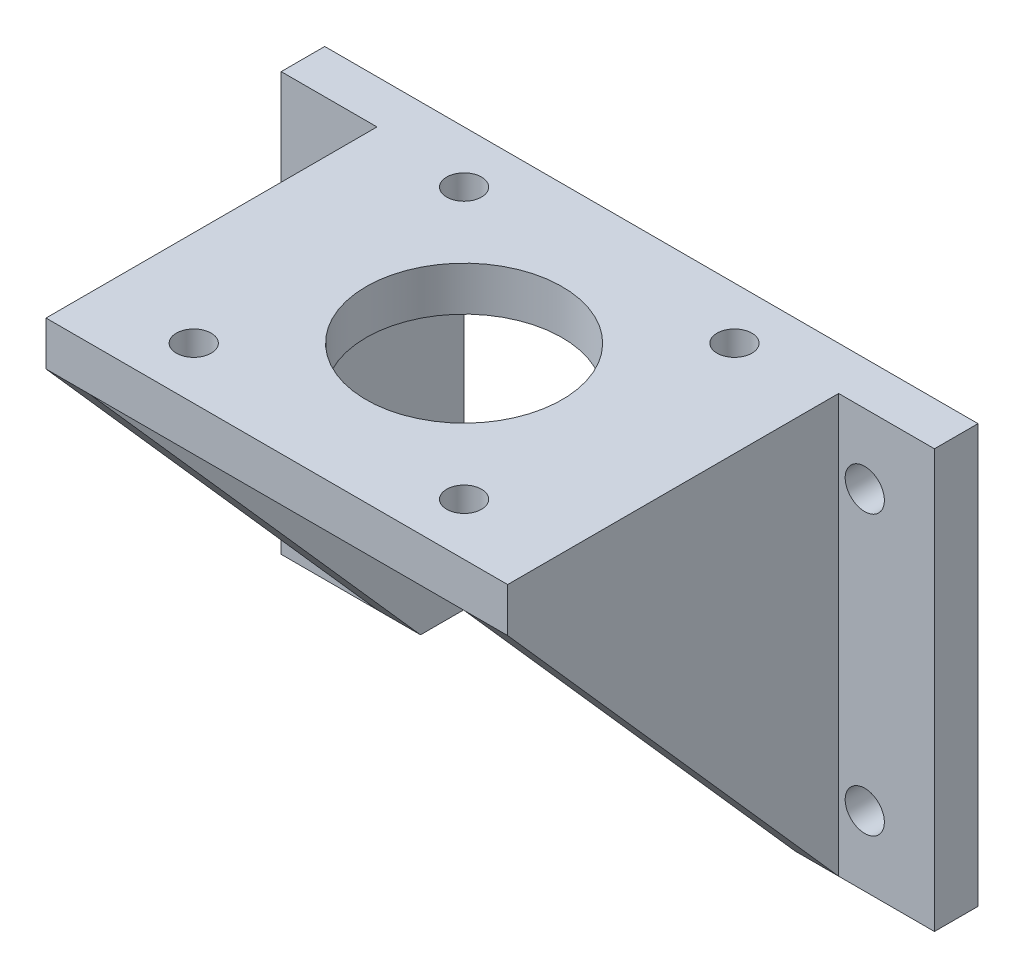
SolidWorks part; units mm, degrees
ref_plane "Front Plane" through (0, 0, 0) normal (0, 0, 1) x (1, 0, 0)
ref_plane "Top Plane" through (0, 0, 0) normal (0, 1, 0) x (1, 0, 0)
ref_plane "Right Plane" through (0, 0, 0) normal (1, 0, 0) x (0, 0, -1)
sketch "Sketch1" plane through (0, 0, 0) normal (0, 0, 1) x (1, 0, 0)
  line L0 (0, 0) -> (0, 43)
  line L1 (0, 43) -> (43, 43)
  line L2 (43, 43) -> (43, 0)
  line L3 (43, 0) -> (59, 0)
  line L4 (59, 0) -> (59, 48)
  line L5 (59, 48) -> (-16, 48)
  line L6 (-16, 48) -> (-16, 0)
  line L7 (-16, 0) -> (0, 0)
  circle A0 centre (-8, 40) radius 2.25
  circle A1 centre (51, 40) radius 2.25
  circle A2 centre (51, 8) radius 2.25
  circle A3 centre (-8, 8) radius 2.25
  dimension "D5" = 8
  dimension "D1" = 16
  dimension "D2" = 16
  dimension "D3" = 5
  dimension "D4" = 43
  dimension "D6" = 8
  dimension "D7" = 2
  dimension "D8" = 2
extrude "Boss-Extrude1" add sketch "Sketch1" along normal blind 5
sketch "Sketch2" plane through (0, 0, 5) normal (0, 0, 1) x (1, 0, 0)
  line L1 (59, 48) -> (-16, 48) construction
  line L2 (-5, 42.9307) -> (48, 42.9307)
  line L3 (-5, 42.9307) -> (-5, 48)
  line L4 (-5, 48) -> (48, 48)
  line L5 (48, 42.9307) -> (48, 48)
  line L6 (0, 0) -> (0, 43) construction
  line L7 (43, 43) -> (43, 0) construction
  dimension "D1" = 5
  dimension "D2" = 5
extrude "Boss-Extrude2" add sketch "Sketch2" along normal blind 38
ref_plane "Plane1" through (-5, 0, 0) normal (-1, 0, 0) x (0, 0, 1)
sketch "Sketch3" plane through (-5, 0, 0) normal (-1, 0, 0) x (0, 0, 1)
  line L0 (5, 48) -> (5, 0)
  line L1 (43, 48) -> (5, 48) construction
  line L2 (5, 48) -> (5, 42.9307) construction
  line L3 (5, 0) -> (43, 42.9307)
  line L4 (43, 42.9307) -> (43, 48)
  line L5 (43, 48) -> (5, 48)
extrude "Boss-Extrude3" add sketch "Sketch3" against normal blind 5
ref_plane "Plane2" through (48, 0, 0) normal (1, 0, 0) x (0, 0, -1)
sketch "Sketch4" plane through (48, 0, 0) normal (1, 0, 0) x (0, 0, -1)
  line L0 (-43, 48) -> (-43, 42.9307)
  line L1 (-43, 42.9307) -> (-5, 0)
  line L2 (-5, 0) -> (-5, 48)
  line L3 (-5, 48) -> (-43, 48)
extrude "Boss-Extrude4" add sketch "Sketch4" against normal blind 5
sketch "Sketch5" plane through (0, 48, 0) normal (0, 1, 0) x (1, 0, 0)
  line L0 (-5, 20.9) -> (-5, -20.9) construction
  line L1 (48, -20.9) -> (48, 20.9) construction
  line L2 (59, 0) -> (-16, 0) construction
  line L3 (48, -43) -> (-5, -43) construction
  circle A0 centre (21.5, -21.5) radius 11.25
  circle A1 centre (5.98, -5.98) radius 2
  circle A2 centre (37.02, -5.98) radius 2
  circle A3 centre (37.02, -37.02) radius 2
  circle A4 centre (5.98, -37.02) radius 2
  dimension "D1" = 22.5
  dimension "D6" = 15.52
  dimension "D2" = 26.5
  dimension "D3" = 26.5
  dimension "D4" = 21.5
  dimension "D5" = 21.5
  dimension "D7" = 15.52
  dimension "D8" = 2
  dimension "D9" = 2
extrude "Cut-Extrude1" cut sketch "Sketch5" against normal through all
